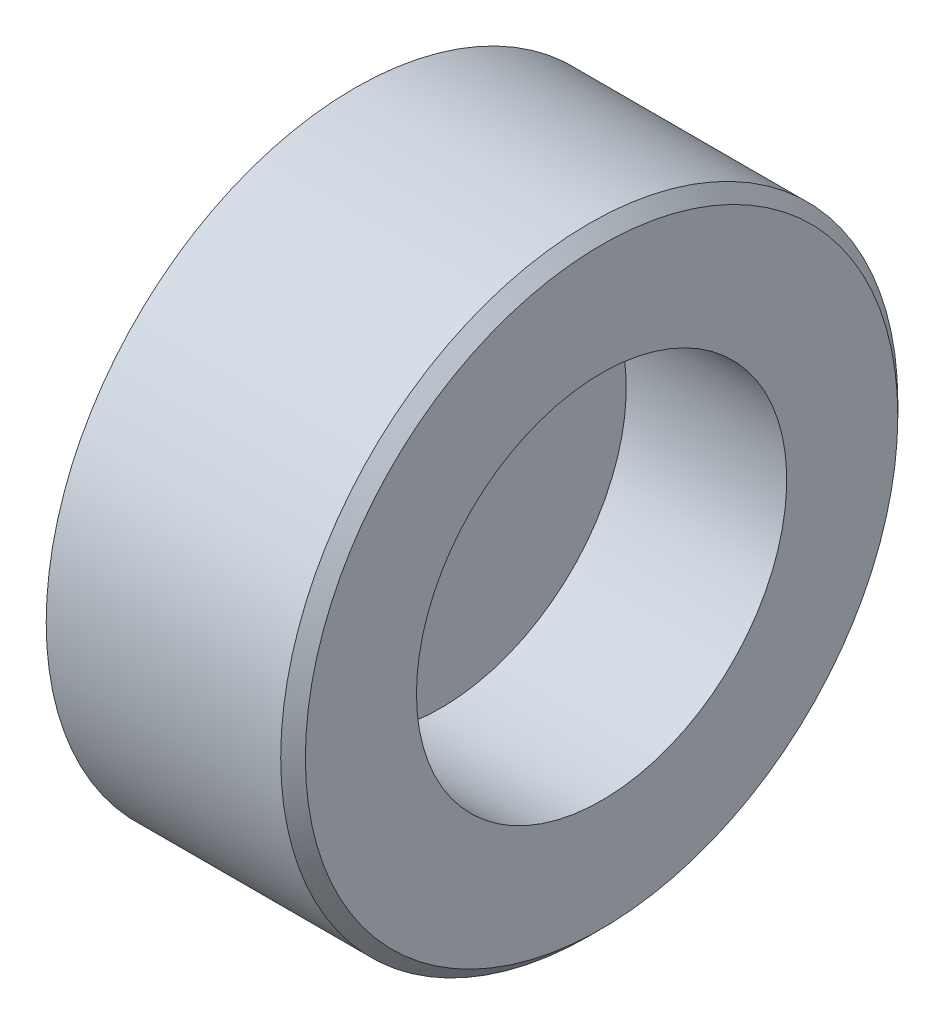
SolidWorks part; units mm, degrees
ref_plane "Vorne" through (0, 0, 0) normal (0, 0, 1) x (1, 0, 0)
ref_plane "Oben" through (0, 0, 0) normal (0, 1, 0) x (1, 0, 0)
ref_plane "Rechts" through (0, 0, 0) normal (1, 0, 0) x (0, 0, -1)
sketch "Skizze1" plane through (0, 0, 0) normal (0, 0, 1) x (1, 0, 0)
  line L0 (0, 0) -> (43.7697, 0) construction
  line L1 (0, 0) -> (0, 2.5)
  line L2 (0, 2.5) -> (2, 2.5)
  line L3 (2, 2.5) -> (2, 1.5)
  line L4 (2, 1.5) -> (0.7, 1.5)
  line L5 (0.7, 1.5) -> (0.7, 0)
  line L6 (0, 0) -> (0.7, 0)
  dimension "D1" = 3
  dimension "D2" = 5
  dimension "D3" = 2
  dimension "D4" = 0.7
revolve "Rotation1" add sketch "Skizze1" angle 360 about L0
hole_wizard "Ø0.15 (0.15) Durchmesser Bohrung1" positions "Skizze4" profile "Skizze3" hole size "Ø0.15" standard "ISO"
sketch "Skizze4" plane through (0, 0, 0) normal (-1, 0, 0) x (0, 0, 1)
  line L0 (-0.1531, 0) -> (0.1015, 0) construction
  point P1 (0, -0.14)
  point P3 (0, 0.14)
  dimension "D1" = 0.28
sketch "Skizze3" plane through (0, -0.14, 0) normal (0, 1, 0) x (0, 0, 1)
  line L0 (0, 0) -> (0, 2)
  line L1 (0, 2) -> (0.0656, 2)
  line L2 (0.0656, 2) -> (0.0656, 0)
  line L5 (0.0656, 0) -> (0, 0)
  line L11 (0, -6.35) -> (0, 107.95) construction
  dimension "Bohrerdurchmesser" = 0.1313
  dimension "Bohrungstiefe" = 2
chamfer "Fase1" distance 0.05 angle 45 2 edges at (0.7, 0.14, 0.0656) (0.7, -0.14, 0.0656)
chamfer "Fase2" distance 0.1 angle 45 1 edges at (2, 0, 2.5)
